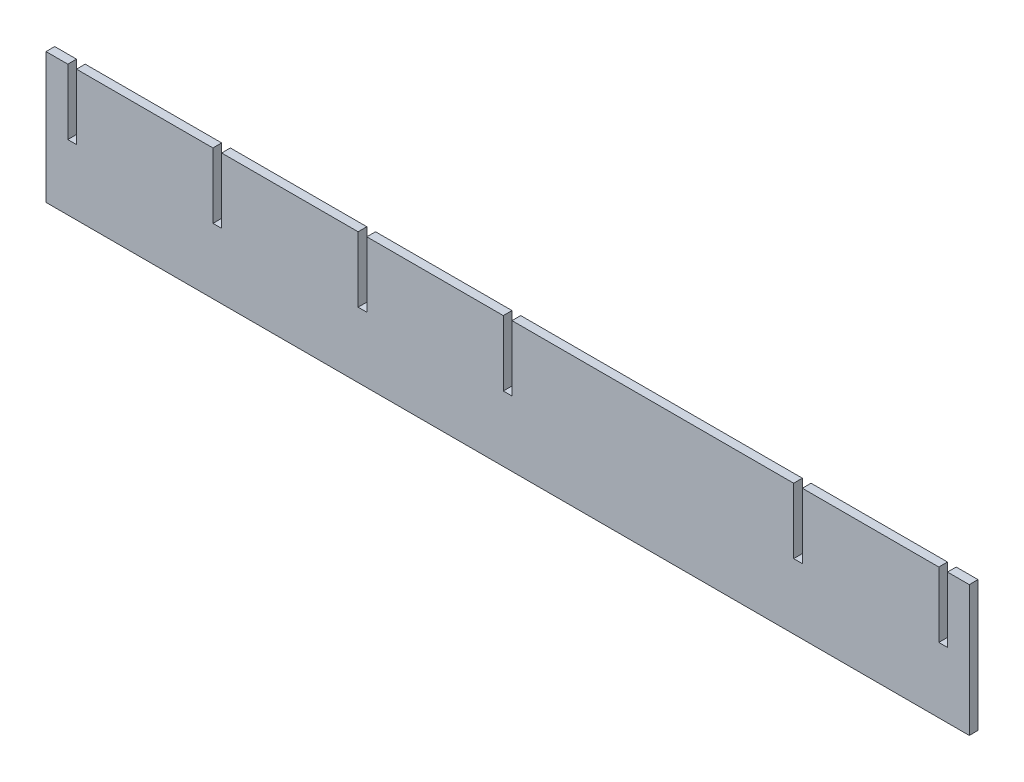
SolidWorks part; units mm, degrees
ref_plane "Alzado" through (0, 0, 0) normal (1, 0, 0) x (0, 1, 0)
ref_plane "Planta" through (0, 0, 0) normal (0, 0, 1) x (0, 1, 0)
ref_plane "Vista lateral" through (0, 0, 0) normal (0, 1, 0) x (-1, 0, 0)
sketch "Sketch3" plane through (0, 0, 0) normal (0, 0, 1) x (0, 1, 0)
  line L0 (90, -394) -> (90, -406)
  line L1 (-90, 636) -> (90, 636)
  line L2 (-90, 636) -> (-90, -636)
  line L3 (-90, -636) -> (90, -636)
  line L4 (90, 636) -> (90, -636)
  line L5 (-90, 636) -> (90, -636) construction
  line L6 (-90, -636) -> (90, 636) construction
  line L7 (90, -594) -> (0, -594)
  line L8 (90, -594) -> (90, -606)
  line L9 (90, -606) -> (0, -606)
  line L10 (0, -594) -> (0, -606)
  line L11 (90, -394) -> (0, -394)
  line L12 (0, -394) -> (0, -406)
  line L13 (90, -406) -> (0, -406)
  line L14 (90, -594) -> (90, -394) construction
  line L15 (90, -194) -> (90, -206) construction
  line L16 (90, -194) -> (0, -194) construction
  line L17 (0, -194) -> (0, -206) construction
  line L18 (90, -206) -> (0, -206) construction
  line L19 (90, 6) -> (90, -6)
  line L20 (90, 6) -> (0, 6)
  line L21 (0, 6) -> (0, -6)
  line L22 (90, -6) -> (0, -6)
  line L23 (90, 206) -> (90, 194)
  line L24 (90, 206) -> (0, 206)
  line L25 (0, 206) -> (0, 194)
  line L26 (90, 194) -> (0, 194)
  line L27 (90, 406) -> (90, 394)
  line L28 (90, 406) -> (0, 406)
  line L29 (0, 406) -> (0, 394)
  line L30 (90, 394) -> (0, 394)
  line L31 (90, 606) -> (90, 594)
  line L32 (90, 606) -> (0, 606)
  line L33 (0, 606) -> (0, 594)
  line L34 (90, 594) -> (0, 594)
  point P0 (0, 0)
extrude "Boss-Extrude1" add sketch "Sketch3" along normal blind 12 contours L4 L30 L29 L28 L1 L2 L3 L9 L10 L7 L13 L12 L11 L18 L17 L16 L22 L21 L20 L26 L25 L24
equation "\"L\"=180"
equation "\"D1@Sketch3\"=\"L\""
equation "\"W\"=12"
equation "\"D3@Sketch3\"=\"W\""
equation "\"D4@Sketch3\"=\"L\"/2"
equation "\"H\"=1700"
equation "\"D2@Sketch3\" = ( ( \"K\" * ( \"N\" - 1 ) ) + ( \"B\" * 2 ) ) + \"W\""
equation "\"B\"=30"
equation "\"D5@Sketch3\"=\"B\""
equation "\"K\"=200"
equation "\"D7@Sketch3\"=\"K\""
equation "\"D6@Sketch3\"=\"N\""
equation "\"N\"=7"
